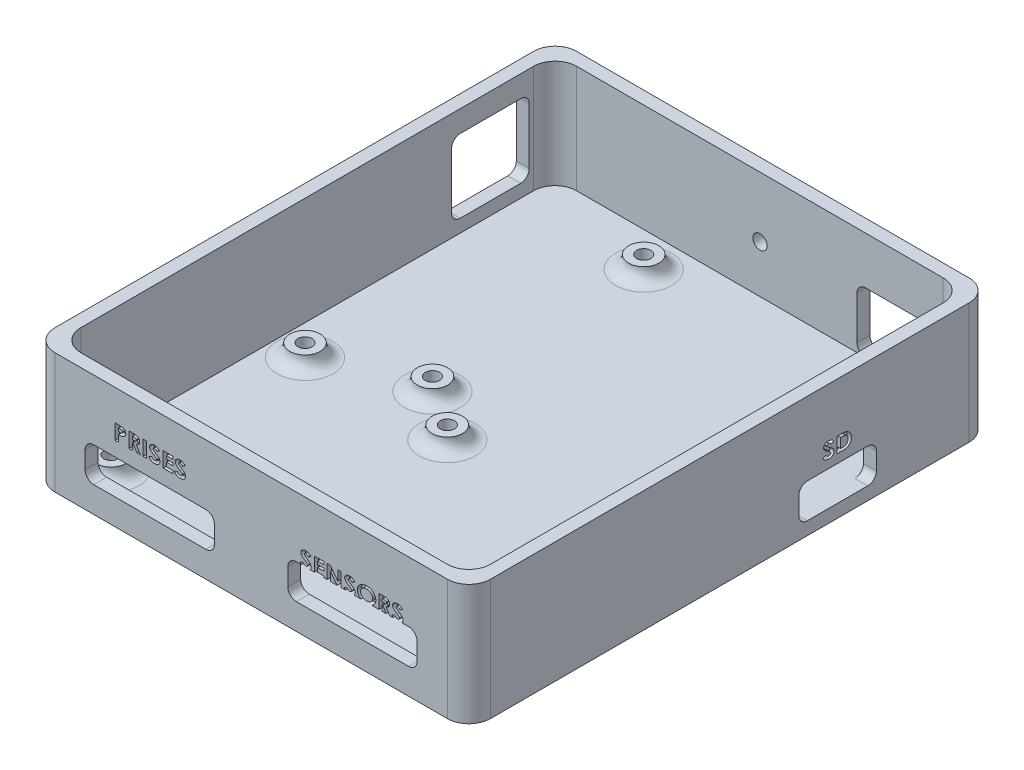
SolidWorks part; units mm, degrees
ref_plane "Plan de face" through (0, 0, 0) normal (0, 0, 1) x (1, 0, 0)
ref_plane "Plan de dessus" through (0, 0, 0) normal (0, 1, 0) x (1, 0, 0)
ref_plane "Plan de droite" through (0, 0, 0) normal (1, 0, 0) x (0, 0, -1)
sketch "Esquisse1" plane through (0, 0, 0) normal (0, 1, 0) x (1, 0, 0)
  line L1 (-42.7966, 45.9758) -> (58.2034, 45.9758)
  line L2 (-42.7966, 45.9758) -> (-42.7966, -75.0242)
  line L3 (-42.7966, -75.0242) -> (58.2034, -75.0242)
  line L4 (58.2034, 45.9758) -> (58.2034, -75.0242)
  dimension "D1" = 101
  dimension "D2" = 121
extrude "Boss.-Extru.1" add sketch "Esquisse1" along normal blind 3
sketch "Esquisse2" plane through (0, 3, 0) normal (0, 1, 0) x (1, 0, 0)
  line L5 (-42.7966, 45.9758) -> (58.2034, 45.9758)
  line L6 (-42.7966, 45.9758) -> (-42.7966, -75.0242)
  line L7 (-42.7966, -75.0242) -> (58.2034, -75.0242)
  line L8 (-39.7966, 42.9758) -> (-39.7966, -72.0242)
  line L9 (-39.7966, -72.0242) -> (55.2034, -72.0242)
  line L10 (55.2034, -72.0242) -> (55.2034, 42.9758)
  line L11 (55.2034, 42.9758) -> (-39.7966, 42.9758)
  line L12 (-39.7966, 42.9758) -> (-39.7966, -72.0242)
  line L13 (-39.7966, -72.0242) -> (55.2034, -72.0242)
  line L14 (55.2034, -72.0242) -> (55.2034, 42.9758)
  line L15 (55.2034, 42.9758) -> (-39.7966, 42.9758)
  line L16 (58.2034, 45.9758) -> (58.2034, -75.0242)
  dimension "D1" = 3
extrude "Boss.-Extru.2" add sketch "Esquisse2" along normal blind 25
fillet "Congé1" radius 5 4 edges at (-42.7966, 14, 75.0242) (58.2034, 14, 75.0242) (58.2034, 14, -45.9758) (-42.7966, 14, -45.9758)
sketch "Esquisse3" plane through (0, 3, 0) normal (0, 1, 0) x (1, 0, 0)
  line L0 (17.7534, 35.9342) -> (17.7534, 23.4459) construction
  line L1 (5.4719, 10.4758) -> (15.307, 10.4758) construction
  line L2 (55.2034, -72.0242) -> (55.2034, 42.9758) construction
  line L3 (55.2034, 42.9758) -> (-39.7966, 42.9758) construction
  circle A0 centre (-11.2466, 34.9758) radius 1.65
  circle A1 centre (46.7534, 34.9758) radius 1.65
  circle A2 centre (46.7534, -14.0242) radius 1.65
  circle A3 centre (-11.2466, -14.0242) radius 1.65
  dimension "D1" = 3.3
  dimension "D2" = 58
  dimension "D3" = 49
  dimension "D4" = 8.45
  dimension "D5" = 8
extrude "Enlèv. mat.-Extru.1" cut sketch "Esquisse3" against normal through all
fillet "Congé3" radius 5 4 edges at (55.2034, 15.5, 72.0242) (-39.7966, 15.5, 72.0242) (-39.7966, 15.5, -42.9758) (55.2034, 15.5, -42.9758)
sketch "Esquisse9" plane through (58.2034, 0, 0) normal (1, 0, 0) x (0, 0, -1)
  line L0 (-70.0242, 0) -> (40.9758, 0) construction
  line L1 (19.4758, 3) -> (1.4758, 3)
  line L2 (19.4758, 3) -> (19.4758, 11)
  line L3 (19.4758, 11) -> (1.4758, 11)
  line L4 (1.4758, 3) -> (1.4758, 11)
  line L5 (45.9758, 28) -> (45.9758, 0) construction
  dimension "D1" = 18
  dimension "D2" = 3
  dimension "D3" = 8
  dimension "D4" = 26.5
extrude "Enlèv. mat.-Extru.3" cut sketch "Esquisse9" against normal up to next
sketch "Esquisse10" plane through (0, 0, -45.9758) normal (0, 0, -1) x (-1, 0, 0)
  line L0 (-53.2034, 0) -> (37.7966, 0) construction
  line L1 (-48.2034, 3) -> (-30.2034, 3)
  line L2 (-48.2034, 3) -> (-48.2034, 17)
  line L3 (-48.2034, 17) -> (-30.2034, 17)
  line L4 (-30.2034, 3) -> (-30.2034, 17)
  line L5 (-58.2034, 0) -> (-58.2034, 28) construction
  dimension "D1" = 3
  dimension "D2" = 14
  dimension "D3" = 18
  dimension "D4" = 10
extrude "Enlèv. mat.-Extru.4" cut sketch "Esquisse10" against normal up to next
sketch "Esquisse12" plane through (-42.7966, 0, 0) normal (-1, 0, 0) x (0, 0, 1)
  line L0 (-40.9758, 0) -> (70.0242, 0) construction
  line L1 (-36.9758, 23) -> (-18.9758, 23)
  line L2 (-36.9758, 23) -> (-36.9758, 6)
  line L3 (-36.9758, 6) -> (-18.9758, 6)
  line L4 (-18.9758, 23) -> (-18.9758, 6)
  line L5 (-45.9758, 0) -> (-45.9758, 28) construction
  dimension "D1" = 6
  dimension "D2" = 17
  dimension "D3" = 18
  dimension "D4" = 9
extrude "Enlèv. mat.-Extru.5" cut sketch "Esquisse12" against normal up to next
sketch "Esquisse13" plane through (0, 3, 0) normal (0, 1, 0) x (1, 0, 0)
  line L0 (-34.7966, -72.0242) -> (50.2034, -72.0242) construction
  line L1 (-39.7966, 37.9758) -> (-39.7966, -67.0242) construction
  line L2 (-16.2966, -57.7353) -> (-16.2966, -48.6273) construction
  line L3 (-20.4458, -44.5242) -> (-13.1141, -44.5242) construction
  circle A0 centre (0.2034, -67.0242) radius 1.65
  circle A1 centre (-32.7966, -67.0242) radius 1.65
  circle A2 centre (-32.7966, -22.0242) radius 1.65
  circle A3 centre (0.2034, -22.0242) radius 1.65
  dimension "D1" = 3.3
  dimension "D2" = 5
  dimension "D3" = 7
  dimension "D4" = 45
  dimension "D5" = 33
extrude "Enlèv. mat.-Extru.6" cut sketch "Esquisse13" against normal through all
sketch "Esquisse14" plane through (0, 3, 0) normal (0, 1, 0) x (1, 0, 0)
  circle A0 centre (0.2034, -22.0242) radius 3.5
  circle A1 centre (0.2034, -22.0242) radius 1.65
  dimension "D1" = 7
extrude "Boss.-Extru.7" add sketch "Esquisse14" along normal blind 3
sketch "Esquisse15" plane through (0, 3, 0) normal (0, 1, 0) x (1, 0, 0)
  circle A0 centre (-32.7966, -22.0242) radius 3.5
  circle A1 centre (-32.7966, -22.0242) radius 1.65
  dimension "D1" = 7
extrude "Boss.-Extru.8" add sketch "Esquisse15" along normal blind 3
sketch "Esquisse16" plane through (0, 3, 0) normal (0, 1, 0) x (1, 0, 0)
  circle A0 centre (-32.7966, -67.0242) radius 3.5
  circle A1 centre (-32.7966, -67.0242) radius 1.65
  dimension "D1" = 7
extrude "Boss.-Extru.9" add sketch "Esquisse16" along normal blind 3
sketch "Esquisse17" plane through (0, 3, 0) normal (0, 1, 0) x (1, 0, 0)
  circle A0 centre (0.2034, -67.0242) radius 3.5
  circle A1 centre (0.2034, -67.0242) radius 1.65
  dimension "D1" = 7
extrude "Boss.-Extru.10" add sketch "Esquisse17" along normal blind 3
sketch "Esquisse20" plane through (0, 0, 75.0242) normal (0, 0, 1) x (1, 0, 0)
  line L0 (-37.7966, 0) -> (53.2034, 0) construction
  line L1 (-30.7966, 14) -> (-0.7966, 14)
  line L2 (-30.7966, 14) -> (-30.7966, 6)
  line L3 (-30.7966, 6) -> (-0.7966, 6)
  line L4 (-0.7966, 14) -> (-0.7966, 6)
  line L5 (-42.7966, 0) -> (-42.7966, 28) construction
  dimension "D1" = 6
  dimension "D2" = 8
  dimension "D3" = 30
  dimension "D4" = 12
extrude "Enlèv. mat.-Extru.7" cut sketch "Esquisse20" against normal up to next
fillet "Congé6" radius 2 16 edges at (-41.2966, 23, -18.9758) (-41.2966, 23, -36.9758) (-41.2966, 6, -18.9758) (-41.2966, 6, -36.9758) (30.2034, 17, -44.4758) (48.2034, 17, -44.4758) (30.2034, 3, -44.4758) (48.2034, 3, -44.4758) (56.7034, 11, -19.4758) (56.7034, 11, -1.4758) (56.7034, 3, -19.4758) (56.7034, 3, -1.4758) (-0.7966, 14, 73.5242) (-0.7966, 6, 73.5242) (-30.7966, 14, 73.5242) (-30.7966, 6, 73.5242)
sketch "Esquisse22" plane through (0, 0, 75.0242) normal (0, 0, 1) x (1, 0, 0)
  line L0 (58.2034, 28) -> (58.2034, 0) construction
  line L1 (16.2034, 6) -> (46.2034, 6)
  line L2 (16.2034, 6) -> (16.2034, 14)
  line L3 (16.2034, 14) -> (46.2034, 14)
  line L4 (46.2034, 6) -> (46.2034, 14)
  line L5 (-37.7966, 0) -> (53.2034, 0) construction
  dimension "D1" = 8
  dimension "D2" = 30
  dimension "D3" = 12
  dimension "D4" = 6
extrude "Enlèv. mat.-Extru.8" cut sketch "Esquisse22" against normal up to next
fillet "Congé7" radius 2 4 edges at (46.2034, 6, 73.5242) (46.2034, 14, 73.5242) (16.2034, 6, 73.5242) (16.2034, 14, 73.5242)
sketch "Esquisse24" plane through (0, 3, 0) normal (0, 1, 0) x (1, 0, 0)
  line L0 (55.2034, -67.0242) -> (55.2034, 3.4758) construction
  line L1 (-34.7966, -72.0242) -> (50.2034, -72.0242) construction
  circle A0 centre (40.2034, -34.0242) radius 1.65
  circle A1 centre (25.2034, -54.0242) radius 1.65
  dimension "D5" = 3.3
  dimension "D1" = 15
  dimension "D2" = 20
  dimension "D3" = 15
  dimension "D4" = 18
extrude "Enlèv. mat.-Extru.9" cut sketch "Esquisse24" against normal up to next
sketch "Esquisse26" plane through (0, 3, 0) normal (0, 1, 0) x (1, 0, 0)
  circle A0 centre (40.2034, -34.0242) radius 4
  circle A1 centre (40.2034, -34.0242) radius 1.65
  dimension "D1" = 8
extrude "Boss.-Extru.11" add sketch "Esquisse26" along normal blind 3
sketch "Esquisse27" plane through (0, 3, 0) normal (0, 1, 0) x (1, 0, 0)
  circle A0 centre (25.2034, -54.0242) radius 4
  circle A1 centre (25.2034, -54.0242) radius 1.65
  dimension "D1" = 8
extrude "Boss.-Extru.12" add sketch "Esquisse27" along normal blind 3
fillet "Congé8" radius 3 2 edges at (25.2034, 3, 58.0242) (40.2034, 3, 38.0242)
sketch "Esquisse28" plane through (0, 0, 0) normal (0, -1, 0) x (1, 0, 0)
  line L1 (36.9034, 34.0242) -> (38.5534, 31.1663)
  line L2 (38.5534, 31.1663) -> (41.8534, 31.1663)
  line L3 (41.8534, 31.1663) -> (43.5034, 34.0242)
  line L4 (43.5034, 34.0242) -> (41.8534, 36.8821)
  line L5 (41.8534, 36.8821) -> (38.5534, 36.8821)
  line L6 (38.5534, 36.8821) -> (36.9034, 34.0242)
  circle A0 centre (40.2034, 34.0242) radius 2.8579 construction
  dimension "D1" = 6.6
extrude "Enlèv. mat.-Extru.10" cut sketch "Esquisse28" against normal blind 2
sketch "Esquisse29" plane through (0, 0, 0) normal (0, -1, 0) x (1, 0, 0)
  line L1 (28.5034, 54.0242) -> (26.8534, 56.8821)
  line L2 (26.8534, 56.8821) -> (23.5534, 56.8821)
  line L3 (23.5534, 56.8821) -> (21.9034, 54.0242)
  line L4 (21.9034, 54.0242) -> (23.5534, 51.1663)
  line L5 (23.5534, 51.1663) -> (26.8534, 51.1663)
  line L6 (26.8534, 51.1663) -> (28.5034, 54.0242)
  line L7 (3.5034, 67.0242) -> (1.8534, 69.8821)
  line L8 (1.8534, 69.8821) -> (-1.4466, 69.8821)
  line L9 (-1.4466, 69.8821) -> (-3.0966, 67.0242)
  line L10 (-3.0966, 67.0242) -> (-1.4466, 64.1663)
  line L11 (-1.4466, 64.1663) -> (1.8534, 64.1663)
  line L12 (1.8534, 64.1663) -> (3.5034, 67.0242)
  line L13 (-29.4966, 67.0242) -> (-31.1466, 69.8821)
  line L14 (-31.1466, 69.8821) -> (-34.4466, 69.8821)
  line L15 (-34.4466, 69.8821) -> (-36.0966, 67.0242)
  line L16 (-36.0966, 67.0242) -> (-34.4466, 64.1663)
  line L17 (-34.4466, 64.1663) -> (-31.1466, 64.1663)
  line L18 (-31.1466, 64.1663) -> (-29.4966, 67.0242)
  line L19 (3.5034, 22.0242) -> (1.8534, 24.8821)
  line L20 (1.8534, 24.8821) -> (-1.4466, 24.8821)
  line L21 (-1.4466, 24.8821) -> (-3.0966, 22.0242)
  line L22 (-3.0966, 22.0242) -> (-1.4466, 19.1663)
  line L23 (-1.4466, 19.1663) -> (1.8534, 19.1663)
  line L24 (1.8534, 19.1663) -> (3.5034, 22.0242)
  line L25 (-29.4966, 22.0242) -> (-31.1466, 24.8821)
  line L26 (-31.1466, 24.8821) -> (-34.4466, 24.8821)
  line L27 (-34.4466, 24.8821) -> (-36.0966, 22.0242)
  line L28 (-36.0966, 22.0242) -> (-34.4466, 19.1663)
  line L29 (-34.4466, 19.1663) -> (-31.1466, 19.1663)
  line L30 (-31.1466, 19.1663) -> (-29.4966, 22.0242)
  circle A0 centre (25.2034, 54.0242) radius 2.8579 construction
  circle A1 centre (0.2034, 67.0242) radius 2.8579 construction
  circle A2 centre (-32.7966, 67.0242) radius 2.8579 construction
  circle A3 centre (0.2034, 22.0242) radius 2.8579 construction
  circle A4 centre (-32.7966, 22.0242) radius 2.8579 construction
  dimension "D1" = 6.6
  dimension "D2" = 6.6
  dimension "D3" = 6.6
  dimension "D4" = 6.6
  dimension "D5" = 6.6
extrude "Enlèv. mat.-Extru.11" cut sketch "Esquisse29" against normal blind 2
sketch "Esquisse30" plane through (0, 0, -45.9758) normal (0, 0, -1) x (-1, 0, 0)
  line L0 (-53.2034, 0) -> (37.7966, 0) construction
  line L2 (-53.2034, 28) -> (-53.2034, 0) construction
  circle A0 centre (-7.7034, 14) radius 10
  circle A1 centre (-7.7034, 14) radius 7.5
  dimension "D1" = 20
  dimension "D2" = 15
  dimension "D3" = 14
  dimension "D4" = 45.5
extrude "Boss.-Extru.13" add sketch "Esquisse30" along normal blind 3
sketch "Esquisse31" plane through (0, 0, -45.9758) normal (0, 0, -1) x (-1, 0, 0)
  circle A0 centre (-7.7034, 14) radius 1.65
  dimension "D1" = 3.3
extrude "Enlèv. mat.-Extru.12" cut sketch "Esquisse31" against normal up to next
fillet "Congé9" radius 3 1 edges at (17.7034, 14, -45.9758)
sketch "Esquisse34" plane through (58.2034, 0, 0) normal (1, 0, 0) x (0, 0, -1)
  line L0 (1.6315, 13) -> (19.3642, 13) construction
  line L1 (-70.0242, 28) -> (40.9758, 28) construction
  text T0 "<b>SD</b>" font "Century Gothic" height 3.5
  dimension "D1" = 15
extrude "Enlèv. mat.-Extru.15" cut sketch "Esquisse34" against normal blind 1
sketch "Esquisse35" plane through (-42.7966, 0, 0) normal (-1, 0, 0) x (0, 0, 1)
  line L0 (-13.9807, 23.2164) -> (-13.9807, 6.3631) construction
  text T0 "<b>RÉSEAU</b>"
extrude "Enlèv. mat.-Extru.16" cut sketch "Esquisse35" against normal blind 1
sketch "Esquisse36" plane through (0, 0, -45.9758) normal (0, 0, -1) x (-1, 0, 0)
  line L0 (-48.094, 21.0562) -> (-30.1602, 21.0562) construction
  text T0 "<b>ALIM</b>" font "Century Gothic" height 3.5
extrude "Enlèv. mat.-Extru.17" cut sketch "Esquisse36" against normal blind 1
sketch "Esquisse37" plane through (0, 0, 75.0242) normal (0, 0, 1) x (1, 0, 0)
  line L0 (-30.8244, 17.3773) -> (-0.8472, 17.3773) construction
  text T0 "<b>PRISES</b>" font "Century Gothic" height 3.5
extrude "Enlèv. mat.-Extru.18" cut sketch "Esquisse37" against normal blind 1
sketch "Esquisse38" plane through (0, 0, 75.0242) normal (0, 0, 1) x (1, 0, 0)
  line L0 (16.2641, 13.7251) -> (45.8763, 13.7251) construction
  text T0 "<b>SENSORS</b>" font "Century Gothic" height 3.5
extrude "Enlèv. mat.-Extru.19" cut sketch "Esquisse38" against normal blind 1
sketch "Esquisse39" plane through (0, 0, -45.9758) normal (0, 0, -1) x (-1, 0, 0)
  line L0 (8.2402, 28) -> (8.2402, 0) construction
  line L1 (-53.2034, 28) -> (37.7966, 28) construction
  line L2 (-53.2034, 0) -> (37.7966, 0) construction
  text T0 "<b>CAMÉRA</b>" font "Century Gothic" height 3.5
extrude "Enlèv. mat.-Extru.20" cut sketch "Esquisse39" against normal blind 1
sketch "Esquisse43" plane through (0, 3, 0) normal (0, 1, 0) x (1, 0, 0)
  circle A0 centre (-11.2466, -14.0242) radius 3.5
  circle A1 centre (-11.2466, -14.0242) radius 1.65
  circle A2 centre (46.7534, -14.0242) radius 1.65
  circle A3 centre (46.7534, -14.0242) radius 3.5
  circle A4 centre (-11.2466, 34.9758) radius 1.65
  circle A5 centre (-11.2466, 34.9758) radius 3.5
  circle A6 centre (46.7534, 34.9758) radius 1.65
  circle A7 centre (46.7534, 34.9758) radius 3.5
  dimension "D1" = 7
  dimension "D2" = 7
  dimension "D3" = 7
  dimension "D4" = 7
extrude "Boss.-Extru.14" add sketch "Esquisse43" along normal blind 3
fillet "Congé11" radius 3 8 edges at (0.2034, 3, 70.5242) (-32.7966, 3, 70.5242) (-32.7966, 3, 25.5242) (0.2034, 3, 25.5242) (-11.2466, 3, 17.5242) (46.7534, 3, 17.5242) (46.7534, 3, -31.4758) (-11.2466, 3, -31.4758)
sketch "Esquisse44" plane through (0, 0, 0) normal (0, -1, 0) x (1, 0, 0)
  line L1 (43.4534, 14.0242) -> (45.1034, 11.1663)
  line L2 (45.1034, 11.1663) -> (48.4034, 11.1663)
  line L3 (48.4034, 11.1663) -> (50.0534, 14.0242)
  line L4 (50.0534, 14.0242) -> (48.4034, 16.8821)
  line L5 (48.4034, 16.8821) -> (45.1034, 16.8821)
  line L6 (45.1034, 16.8821) -> (43.4534, 14.0242)
  line L7 (-14.5466, 14.0242) -> (-12.8966, 11.1663)
  line L8 (-12.8966, 11.1663) -> (-9.5966, 11.1663)
  line L9 (-9.5966, 11.1663) -> (-7.9466, 14.0242)
  line L10 (-7.9466, 14.0242) -> (-9.5966, 16.8821)
  line L11 (-9.5966, 16.8821) -> (-12.8966, 16.8821)
  line L12 (-12.8966, 16.8821) -> (-14.5466, 14.0242)
  line L13 (43.4534, -34.9758) -> (45.1034, -37.8337)
  line L14 (45.1034, -37.8337) -> (48.4034, -37.8337)
  line L15 (48.4034, -37.8337) -> (50.0534, -34.9758)
  line L16 (50.0534, -34.9758) -> (48.4034, -32.1179)
  line L17 (48.4034, -32.1179) -> (45.1034, -32.1179)
  line L18 (45.1034, -32.1179) -> (43.4534, -34.9758)
  line L19 (-7.9466, -34.9758) -> (-9.5966, -32.1179)
  line L20 (-9.5966, -32.1179) -> (-12.8966, -32.1179)
  line L21 (-12.8966, -32.1179) -> (-14.5466, -34.9758)
  line L22 (-14.5466, -34.9758) -> (-12.8966, -37.8337)
  line L23 (-12.8966, -37.8337) -> (-9.5966, -37.8337)
  line L24 (-9.5966, -37.8337) -> (-7.9466, -34.9758)
  circle A0 centre (46.7534, 14.0242) radius 2.8579 construction
  circle A1 centre (-11.2466, 14.0242) radius 2.8579 construction
  circle A2 centre (46.7534, -34.9758) radius 2.8579 construction
  circle A3 centre (-11.2466, -34.9758) radius 2.8579 construction
  dimension "D1" = 6.6
extrude "Enlèv. mat.-Extru.22" cut sketch "Esquisse44" against normal blind 2
sketch "Esquisse45" plane through (-42.7966, 0, 0) normal (-1, 0, 0) x (0, 0, 1)
  line L0 (0, 6.2515) -> (70.0242, 6.2515) construction
  line L1 (70.0242, 0) -> (70.0242, 28) construction
  text T0 "<b>CLEBREAK</b>" font "Century Gothic" height 8
extrude "Enlèv. mat.-Extru.23" cut sketch "Esquisse45" against normal blind 1
